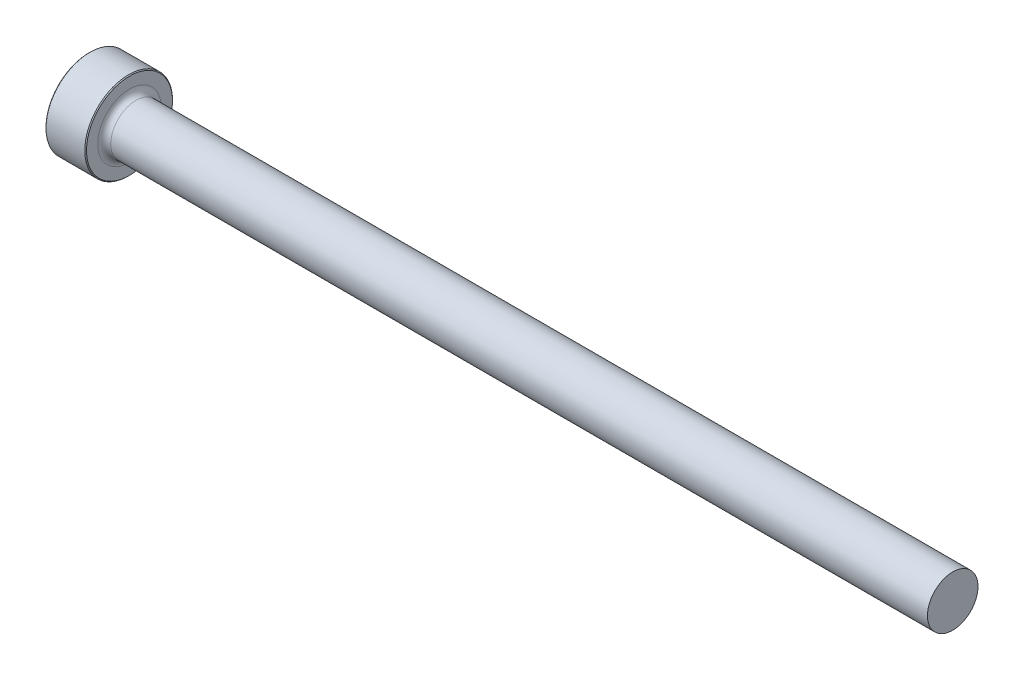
SolidWorks part; units mm, degrees
ref_plane "Front Plane" through (0, 0, 0) normal (0, 0, 1) x (1, 0, 0)
ref_plane "Top Plane" through (0, 0, 0) normal (0, 1, 0) x (1, 0, 0)
ref_plane "Right Plane" through (0, 0, 0) normal (1, 0, 0) x (0, 0, -1)
sketch "Sketch1" plane through (0, 0, 0) normal (0, 0, 1) x (1, 0, 0)
  line L0 (0, 0) -> (0, 5.1594)
  line L1 (0, 5.1594) -> (4.7625, 5.1594)
  line L2 (4.7625, 5.1594) -> (4.7625, 3.7348)
  line L3 (5.5245, 2.9728) -> (101.6, 2.9728)
  line L4 (101.6, 2.9728) -> (101.6, 0)
  line L5 (101.6, 0) -> (0, 0)
  line L6 (101.6, 0) -> (101.6, -2.9728) construction
  line L7 (101.6, -2.9728) -> (4.7625, -2.9728) construction
  line L8 (0, 0) -> (0, -5.1594) construction
  line L9 (0, -5.1594) -> (4.7625, -5.1594) construction
  line L10 (4.7625, -5.1594) -> (4.7625, -2.9728) construction
  arc A0 (4.7625, 3.7348) -> (5.5245, 2.9728) centre (5.5245, 3.7348) ccw
  dimension "D4" = 0.762
  dimension "L" = 101.6
  dimension "D" = 5.9455
  dimension "H" = 10.3187
  dimension "T" = 4.7625
revolve "Revolve1" add sketch "Sketch1" angle 360 about L5
chamfer "Chamfer1" distance 0.1016 angle 45 2 edges at (0, 5.1594, 0) (4.7625, 5.1594, 0)
